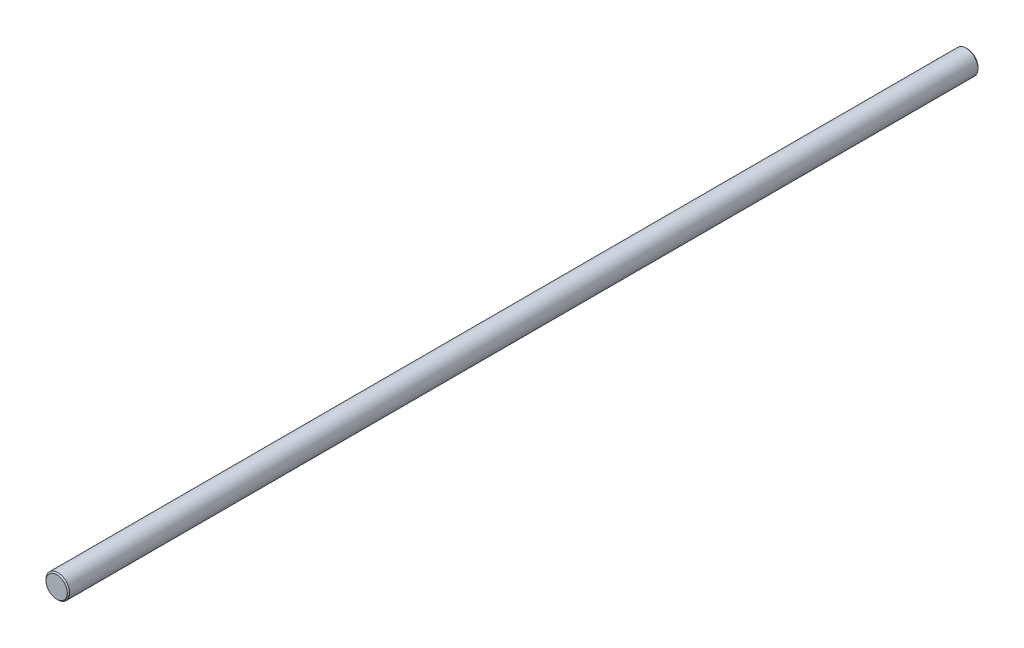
SolidWorks part; units mm, degrees
ref_plane "Plan de face" through (0, 0, 0) normal (0, 0, 1) x (1, 0, 0)
ref_plane "Plan de dessus" through (0, 0, 0) normal (0, 1, 0) x (1, 0, 0)
ref_plane "Plan de droite" through (0, 0, 0) normal (1, 0, 0) x (0, 0, -1)
sketch "Esquisse1" plane through (0, 0, 0) normal (0, 0, 1) x (1, 0, 0)
  circle A0 centre (0, 0) radius 10
  dimension "D1" = 20
extrude "Extrusion1" add sketch "Esquisse1" along normal blind 770
chamfer "Chanfrein1" distance 1 angle 45 2 edges at (10, 0, 770) (10, 0, 0)
